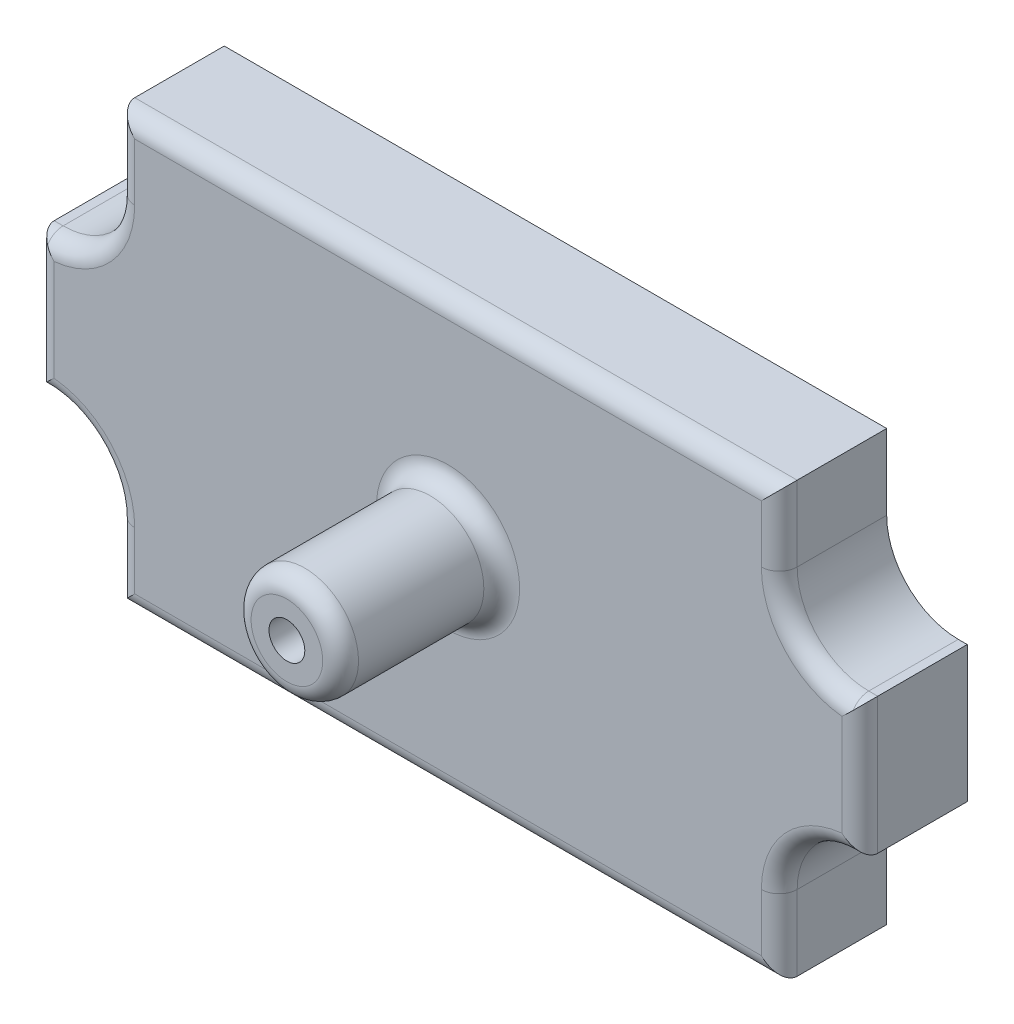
SolidWorks part; units mm, degrees
ref_plane "Plan de face" through (0, 0, 0) normal (0, 0, 1) x (1, 0, 0)
ref_plane "Plan de dessus" through (0, 0, 0) normal (0, 1, 0) x (1, 0, 0)
ref_plane "Plan de droite" through (0, 0, 0) normal (1, 0, 0) x (0, 0, -1)
sketch "Esquisse1" plane through (0, 0, 0) normal (0, 0, 1) x (1, 0, 0)
  line L0 (9.25, 6) -> (-9.25, 6) construction
  line L1 (-9.25, 6) -> (-9.25, 3.9) construction
  line L2 (-11.5, 1.9) -> (-11.5, -1.9) construction
  line L3 (-11.25, 1.9) -> (-11.5, 1.9) construction
  line L4 (9.25, 6) -> (-9.25, 6)
  line L5 (-9.25, 6) -> (-9.25, 3.9)
  line L6 (-11.5, 1.9) -> (-11.5, -1.9)
  line L7 (-11.25, 1.9) -> (-11.5, 1.9)
  line L8 (-11.5, -1.9) -> (-11.25, -1.9) construction
  line L9 (-9.25, -3.9) -> (-9.25, -6) construction
  line L10 (-9.25, -6) -> (9.25, -6) construction
  line L11 (9.25, -6) -> (9.25, -3.9) construction
  line L12 (11.25, -1.9) -> (11.5, -1.9) construction
  line L13 (11.5, -1.9) -> (11.5, 1.9) construction
  line L14 (11.5, 1.9) -> (11.25, 1.9) construction
  line L15 (9.25, 3.9) -> (9.25, 6) construction
  line L16 (-11.5, -1.9) -> (-11.25, -1.9)
  line L17 (-9.25, -3.9) -> (-9.25, -6)
  line L18 (-9.25, -6) -> (9.25, -6)
  line L19 (9.25, -6) -> (9.25, -3.9)
  line L20 (11.25, -1.9) -> (11.5, -1.9)
  line L21 (11.5, -1.9) -> (11.5, 1.9)
  line L22 (11.5, 1.9) -> (11.25, 1.9)
  line L23 (9.25, 3.9) -> (9.25, 6)
  arc A0 (-11.25, 1.9) -> (-9.25, 3.9) centre (-11.25, 3.9) ccw construction
  arc A1 (-11.25, 1.9) -> (-9.25, 3.9) centre (-11.25, 3.9) ccw
  arc A2 (-9.25, -3.9) -> (-11.25, -1.9) centre (-11.25, -3.9) ccw construction
  arc A3 (11.25, -1.9) -> (9.25, -3.9) centre (11.25, -3.9) ccw construction
  arc A4 (9.25, 3.9) -> (11.25, 1.9) centre (11.25, 3.9) ccw construction
  arc A5 (-9.25, -3.9) -> (-11.25, -1.9) centre (-11.25, -3.9) ccw
  arc A6 (11.25, -1.9) -> (9.25, -3.9) centre (11.25, -3.9) ccw
  arc A7 (9.25, 3.9) -> (11.25, 1.9) centre (11.25, 3.9) ccw
extrude "Extrusion1" add sketch "Esquisse1" along normal blind 3
sketch "Esquisse2" plane through (0, 0, 3) normal (0, 0, 1) x (1, 0, 0)
  circle A0 centre (0, 0) radius 1.5
  dimension "D1" = 3
extrude "Extrusion2" add sketch "Esquisse2" along normal blind 4.5
fillet "Congé1" radius 0.5 14 edges at (1.5, 0, 3) (1.5, 0, 7.5) (9.8358, 2.4858, 3) (11.5, 0, 3) (9.8358, -2.4858, 3) (9.25, -4.95, 3) (0, -6, 3) (-9.25, -4.95, 3) (-9.8358, -2.4858, 3) (-11.5, 0, 3) (-9.8358, 2.4858, 3) (-9.25, 4.95, 3) (0, 6, 3) (9.25, 4.95, 3)
sketch "Esquisse3" plane through (0, 0, 0) normal (0, 0, -1) x (-1, 0, 0)
  line L0 (-8.45, 5.2) -> (-8.45, 3.9)
  line L1 (-10.7, 1.1545) -> (-10.7, 1.1545)
  line L2 (-10.7, 1.1545) -> (-10.7, -1.1545)
  line L3 (-10.7, -1.1545) -> (-10.7, -1.1545)
  line L4 (-8.45, -3.9) -> (-8.45, -5.2)
  line L5 (-8.45, -5.2) -> (8.45, -5.2)
  line L6 (8.45, -5.2) -> (8.45, -3.9)
  line L7 (10.7, -1.1545) -> (10.7, -1.1545)
  line L8 (10.7, -1.1545) -> (10.7, 1.1545)
  line L9 (10.7, 1.1545) -> (10.7, 1.1545)
  line L10 (8.45, 3.9) -> (8.45, 5.2)
  line L11 (8.45, 5.2) -> (-8.45, 5.2)
  line L12 (-9.25, 6) -> (-9.25, 3.9)
  line L13 (-11.25, 1.9) -> (-11.5, 1.9)
  line L14 (-11.5, 1.9) -> (-11.5, -1.9)
  line L15 (-11.5, -1.9) -> (-11.25, -1.9)
  line L16 (-9.25, -3.9) -> (-9.25, -6)
  line L17 (-9.25, -6) -> (9.25, -6)
  line L18 (9.25, -6) -> (9.25, -3.9)
  line L19 (11.25, -1.9) -> (11.5, -1.9)
  line L20 (11.5, -1.9) -> (11.5, 1.9)
  line L21 (11.5, 1.9) -> (11.25, 1.9)
  line L22 (9.25, 3.9) -> (9.25, 6)
  line L23 (9.25, 6) -> (-9.25, 6)
  line L24 (-9.25, 6) -> (-9.25, 3.9) construction
  line L25 (-11.25, 1.9) -> (-11.5, 1.9) construction
  line L26 (-11.5, 1.9) -> (-11.5, -1.9) construction
  line L27 (-11.5, -1.9) -> (-11.25, -1.9) construction
  line L28 (-9.25, -3.9) -> (-9.25, -6) construction
  line L29 (-9.25, -6) -> (9.25, -6) construction
  line L30 (9.25, -6) -> (9.25, -3.9) construction
  line L31 (11.25, -1.9) -> (11.5, -1.9) construction
  line L32 (11.5, -1.9) -> (11.5, 1.9) construction
  line L33 (11.5, 1.9) -> (11.25, 1.9) construction
  line L34 (9.25, 3.9) -> (9.25, 6) construction
  line L35 (9.25, 6) -> (-9.25, 6) construction
  arc A0 (-10.7, 1.1545) -> (-8.45, 3.9) centre (-11.25, 3.9) ccw
  arc A1 (-8.45, -3.9) -> (-10.7, -1.1545) centre (-11.25, -3.9) ccw
  arc A2 (10.7, -1.1545) -> (8.45, -3.9) centre (11.25, -3.9) ccw
  arc A3 (8.45, 3.9) -> (10.7, 1.1545) centre (11.25, 3.9) ccw
  arc A4 (-11.25, 1.9) -> (-9.25, 3.9) centre (-11.25, 3.9) ccw
  arc A5 (-9.25, -3.9) -> (-11.25, -1.9) centre (-11.25, -3.9) ccw
  arc A6 (11.25, -1.9) -> (9.25, -3.9) centre (11.25, -3.9) ccw
  arc A7 (9.25, 3.9) -> (11.25, 1.9) centre (11.25, 3.9) ccw
  arc A8 (-11.25, 1.9) -> (-9.25, 3.9) centre (-11.25, 3.9) ccw construction
  arc A9 (-9.25, -3.9) -> (-11.25, -1.9) centre (-11.25, -3.9) ccw construction
  arc A10 (11.25, -1.9) -> (9.25, -3.9) centre (11.25, -3.9) ccw construction
  arc A11 (9.25, 3.9) -> (11.25, 1.9) centre (11.25, 3.9) ccw construction
  dimension "D1" = 0
  dimension "D2" = 0.8
extrude "Enlèv. mat.-Extru.1" cut sketch "Esquisse3" against normal blind 2
sketch "Esquisse5" plane through (0, 0, 7.5) normal (0, 0, 1) x (1, 0, 0)
  circle A0 centre (0, 0) radius 0.5
  dimension "D1" = 1
extrude "Enlèv. mat.-Extru.2" cut sketch "Esquisse5" against normal through all
sketch "Esquisse6" plane through (0, 0, 2) normal (0, 0, -1) x (-1, 0, 0)
  circle A0 centre (-6, 0) radius 0.6 construction
  circle A1 centre (6, 0) radius 0.6 construction
  circle A2 centre (-6, 0) radius 0.6
  circle A3 centre (6, 0) radius 0.6
extrude "Extrusion3" add sketch "Esquisse6" along normal blind 1
